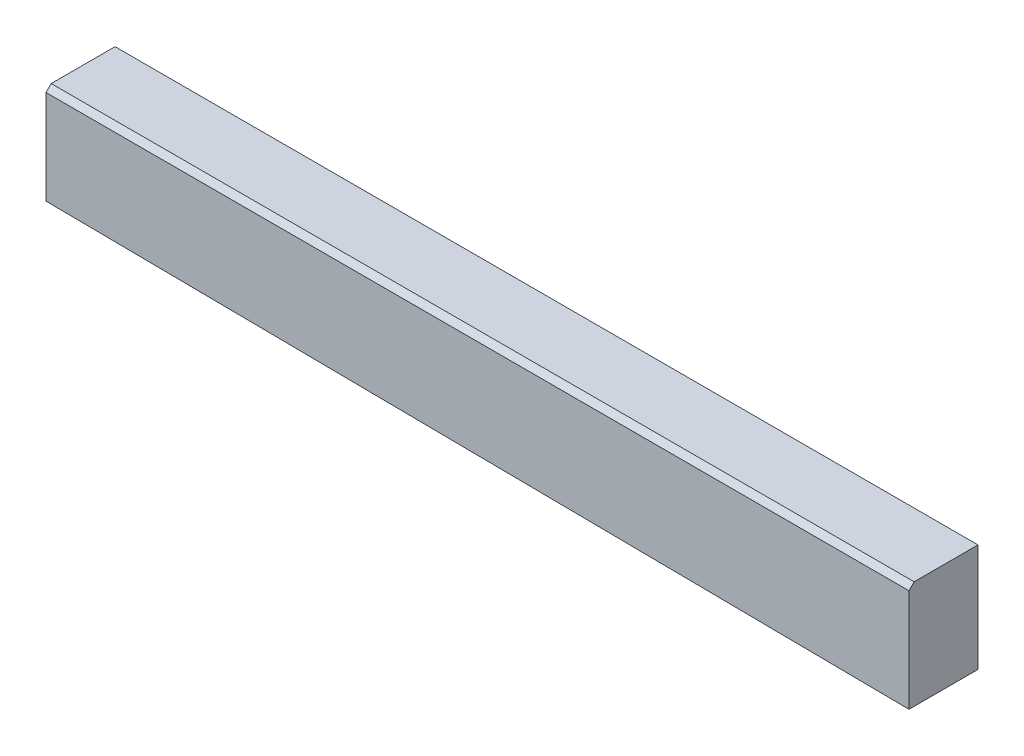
SolidWorks part; units mm, degrees
ref_plane "Front" through (0, 0, 0) normal (0, 0, 1) x (1, 0, 0)
ref_plane "Top" through (0, 0, 0) normal (0, 1, 0) x (1, 0, 0)
ref_plane "Right" through (0, 0, 0) normal (1, 0, 0) x (0, 0, -1)
sketch "Sketch1" plane through (0, 0, 0) normal (0, 0, 1) x (1, 0, 0)
  line L0 (-132.2194, 0) -> (126.609, 0) construction
  line L1 (-100, 24) -> (0, 24)
  line L2 (0, 24) -> (0, 11.5)
  line L3 (0, 11.5) -> (-100, 12.5)
  line L4 (-100, 12.5) -> (-100, 24)
  line L5 (0, 11.5) -> (0, 0)
  line L6 (0, 104.5412) -> (0, -23.7509) construction
  dimension "b" = 24
  dimension "L" = 100
  dimension "D3" = 0.573
extrude "BaseKey" add sketch "Sketch1" along normal mid plane 8 contours L3 L4 L1 L2
chamfer "Chamfer1" distance 0.6 angle 45 1 edges at (-50, 24, 4)
equation "\"D3@Sketch1\" = 1.8 /  pi "
